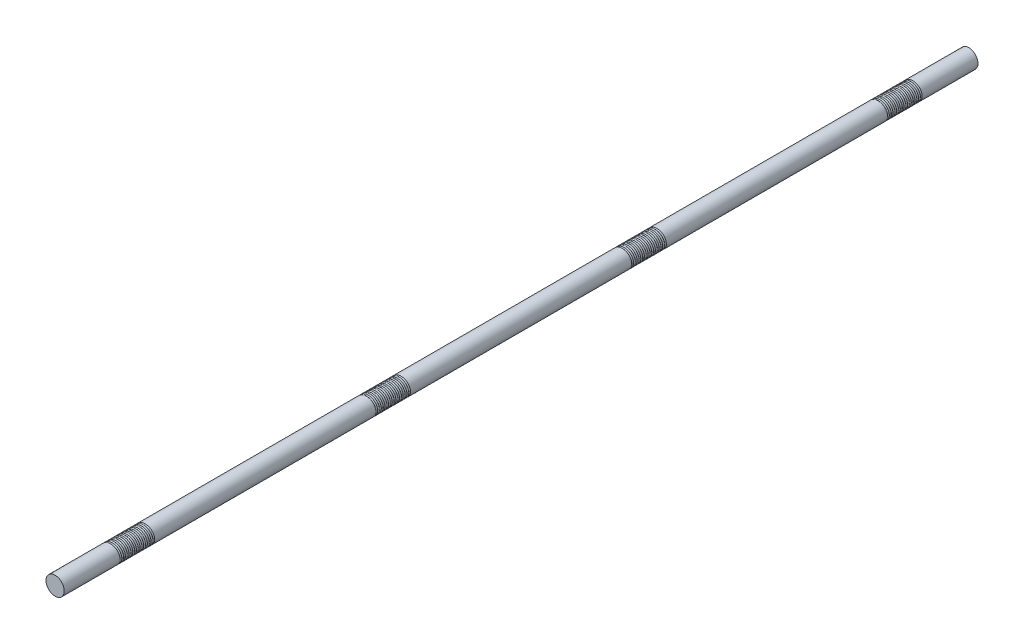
SolidWorks part; units mm, degrees
ref_plane "Front Plane" through (0, 0, 0) normal (0, 0, 1) x (1, 0, 0)
ref_plane "Top Plane" through (0, 0, 0) normal (0, 1, 0) x (1, 0, 0)
ref_plane "Right Plane" through (0, 0, 0) normal (1, 0, 0) x (0, 0, -1)
sketch "Sketch1" plane through (0, 0, 0) normal (0, 0, 1) x (1, 0, 0)
  circle A0 centre (0, 0) radius 25
  dimension "D1" = 50
extrude "Boss-Extrude1" add sketch "Sketch1" along normal blind 2500
ref_plane "Plane1" through (0, 0, 150) normal (0, 0, 1) x (1, 0, 0)
sketch "Sketch2" plane through (0, 0, 150) normal (0, 0, 1) x (1, 0, 0)
  circle A0 centre (0, 0) radius 27.1167
  dimension "D1" = 54.2333
curve "Helix/Spiral1"
sketch "Sketch3" plane through (0, 0, 0) normal (0, 1, 0) x (1, 0, 0)
  circle A0 centre (-27.1167, -150) radius 3.175
  spline S0 degree 3 number of poles 233 (-27.1167, -150) -> (-27.1167, -250) construction
  dimension "D1" = 6.35
sweep "Cut-Sweep1" cut profiles "Sketch3" path "Helix/Spiral1"
pattern_linear "LPattern1" count 4 spacing 700 along (0, 0, -1) of "Cut-Sweep1"
